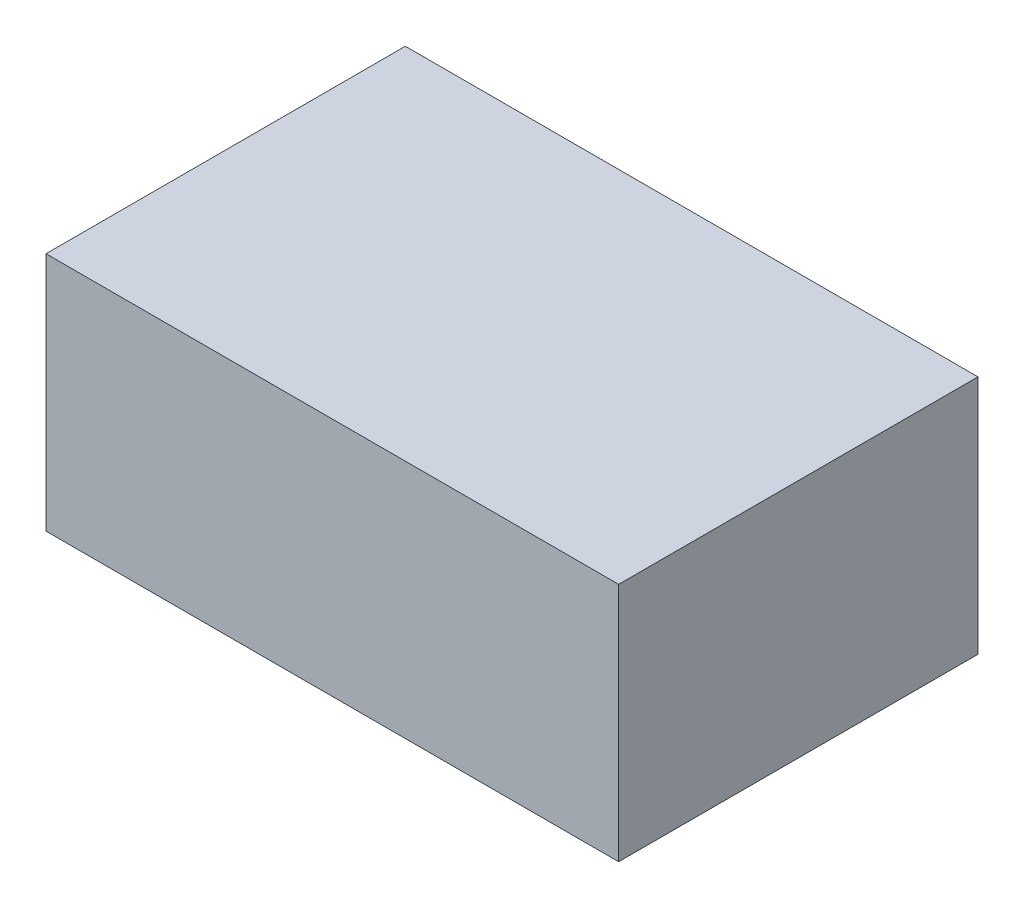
SolidWorks part; units mm, degrees
ref_plane "Front Plane" through (0, 0, 0) normal (0, 0, 1) x (1, 0, 0)
ref_plane "Top Plane" through (0, 0, 0) normal (0, 1, 0) x (1, 0, 0)
ref_plane "Right Plane" through (0, 0, 0) normal (1, 0, 0) x (0, 0, -1)
sketch "Sketch4" plane through (0, 0, 0) normal (0, 1, 0) x (1, 0, 0)
  line L1 (-188.3012, 88.6992) -> (0, 88.6992)
  line L2 (-188.3012, 88.6992) -> (-188.3012, -29.4648)
  line L3 (-188.3012, -29.4648) -> (0, -29.4648)
  line L4 (0, 88.6992) -> (0, -29.4648)
  line L5 (-188.3012, 88.6992) -> (0, -29.4648) construction
  line L6 (-188.3012, -29.4648) -> (0, 88.6992) construction
  point P0 (-94.1506, 29.6172)
extrude "Boss-Extrude2" add sketch "Sketch4" along normal blind 79
